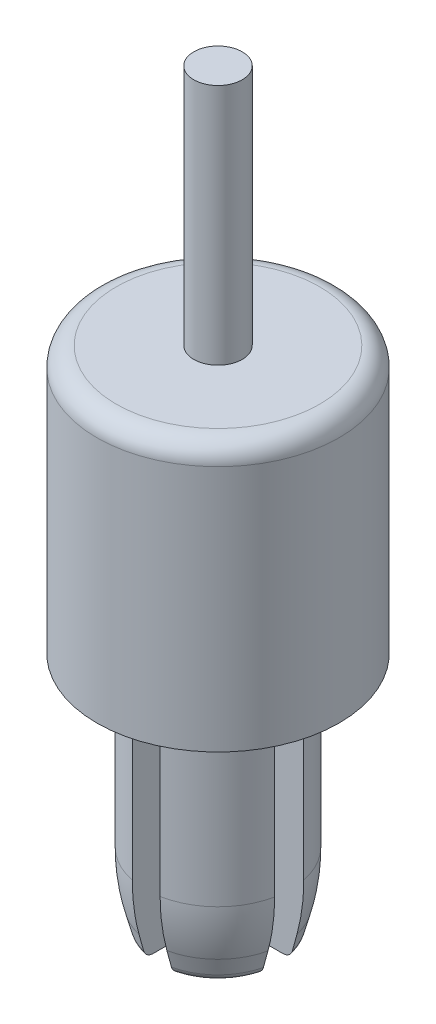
SolidWorks part; units mm, degrees
ref_plane "Front Plane" through (0, 0, 0) normal (0, 0, 1) x (1, 0, 0)
ref_plane "Top Plane" through (0, 0, 0) normal (0, 1, 0) x (1, 0, 0)
ref_plane "Right Plane" through (0, 0, 0) normal (1, 0, 0) x (0, 0, -1)
sketch "Sketch1" plane through (0, 0, 0) normal (0, 0, 1) x (1, 0, 0)
  line L0 (0, 20) -> (0, 0) construction
  line L1 (0, 20) -> (7.5, 20)
  line L2 (2.5, 27.5) -> (2.5, 52.5)
  line L3 (2.5, 52.5) -> (0, 52.5)
  line L4 (7.5, 20) -> (7.5, 0)
  line L7 (2.5, 27.5) -> (12.5, 27.5)
  line L8 (0, 52.5) -> (0, 20)
  line L9 (7.5, 0) -> (12.5, 0)
  line L10 (12.5, 27.5) -> (12.5, 0)
  point P0 (0, 0)
  dimension "D1" = 15
  dimension "D2" = 20
  dimension "D3" = 25
  dimension "D4" = 27.5
  dimension "D5" = 2.5
  dimension "D7" = 25
revolve "Revolve1" add sketch "Sketch1" angle 360 about L0
fillet "Fillet1" radius 2 1 edges at (-12.5, 27.5, 0)
sketch "Sketch2" plane through (0, 20, 0) normal (0, -1, 0) x (1, 0, 0)
  line L0 (0, -7.5) -> (0, 7.5) construction
  line L1 (7.5, 0) -> (-7.5, 0) construction
  line L2 (1.4, -7.5) -> (1.4, 7.5)
  line L3 (7.5, -1.5) -> (-7.5, -1.5)
  line L4 (7.5, 1.5) -> (-7.5, 1.5)
  line L5 (-1.5, -7.5) -> (-1.5, 7.5)
  circle A0 centre (0, 0) radius 7.5
  dimension "D1" = 15
  dimension "D2" = 1.4
  dimension "D3" = 1.5
  dimension "D4" = 1.5
  dimension "D5" = 1.5
extrude "Extrude1" add sketch "Sketch2" along normal blind 45 contours L4 L2 M1 | L3 L2 M1 | L5 L3 M1 | L4 L5 M1
chamfer "Chamfer1" distance 5 angle 15 4 edges at (-5.3033, -25, -5.3033) (-5.3033, -25, 5.3033) (5.2671, -25, 5.3392) (5.2671, -25, -5.3392)
fillet "Fillet2" radius 20 4 edges at (-5.3033, -20, 5.3033) (5.2671, -20, 5.3392) (-5.3033, -20, -5.3033) (5.2671, -20, -5.3392)
fillet "Fillet3" radius 1 4 edges at (4.3194, -25, -4.3922) (-4.356, -25, -4.356) (-4.356, -25, 4.356) (4.3194, -25, 4.3922)
